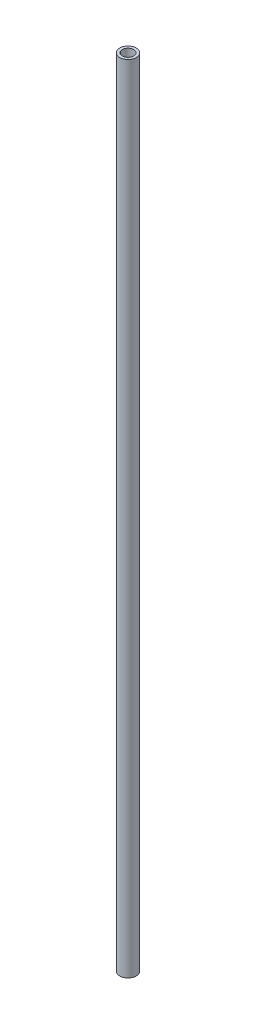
SolidWorks part; units mm, degrees
ref_plane "Front Plane" through (0, 0, 0) normal (0, 0, 1) x (1, 0, 0)
ref_plane "Top Plane" through (0, 0, 0) normal (0, 1, 0) x (1, 0, 0)
ref_plane "Right Plane" through (0, 0, 0) normal (1, 0, 0) x (0, 0, -1)
sketch "Sketch1" plane through (0, 0, 0) normal (0, 1, 0) x (1, 0, 0)
  circle A0 centre (0, 0) radius 3.175
  circle A1 centre (0, 0) radius 2.159
  dimension "D1" = 4.318
  dimension "D2" = 6.35
extrude "Boss-Extrude1" add sketch "Sketch1" along normal blind 304.8
